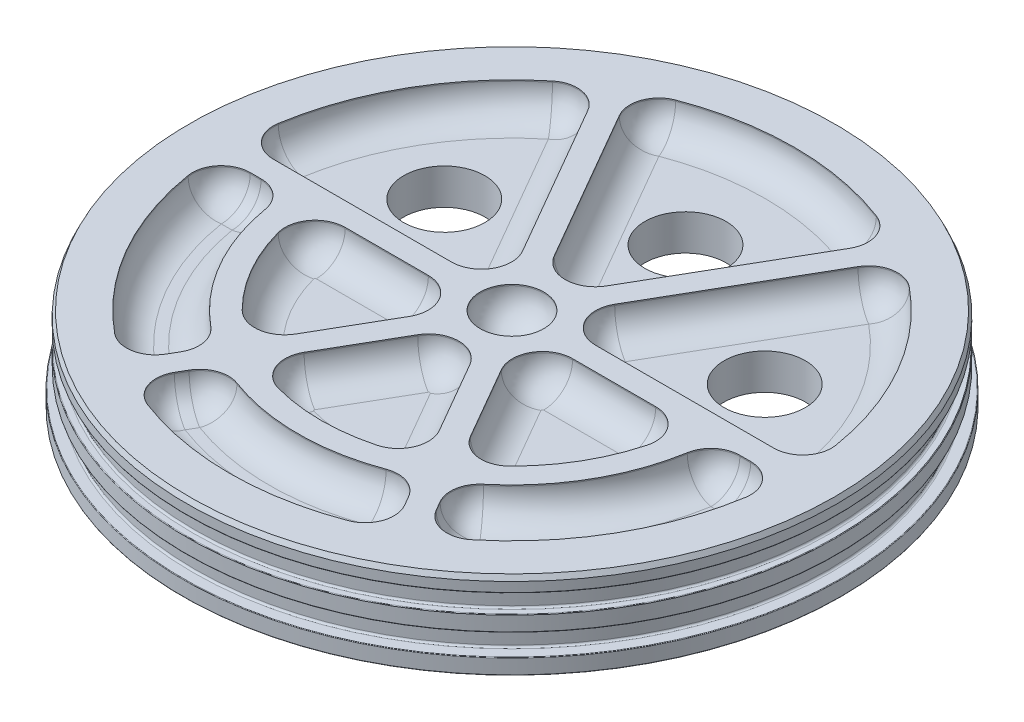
SolidWorks part; units mm, degrees
ref_plane "Front Plane" through (0, 0, 0) normal (0, 0, 1) x (1, 0, 0)
ref_plane "Top Plane" through (0, 0, 0) normal (0, 1, 0) x (1, 0, 0)
ref_plane "Right Plane" through (0, 0, 0) normal (1, 0, 0) x (0, 0, -1)
sketch "Sketch1" plane through (0, 0, 0) normal (0, 0, 1) x (1, 0, 0)
  line L0 (0, 48.1922) -> (0, -25.6743) construction
  line L1 (0, 0) -> (72.39, 0)
  line L2 (72.39, 0) -> (72.39, 3.429)
  line L3 (72.39, 3.429) -> (69.6468, 3.429)
  line L4 (69.6468, 3.429) -> (69.6468, 7.493)
  line L5 (69.6468, 7.493) -> (71.4248, 7.493)
  line L6 (71.4248, 7.493) -> (71.4248, 10.922)
  line L7 (71.4248, 10.922) -> (69.6468, 10.922)
  line L8 (62.0268, 18.288) -> (62.0268, 11.684)
  line L9 (62.0268, 11.684) -> (0, 11.684)
  line L10 (0, 11.684) -> (0, 0)
  line L11 (69.6468, 10.922) -> (69.6468, 14.986)
  line L12 (69.6468, 14.986) -> (71.4248, 14.986)
  line L13 (71.4248, 14.986) -> (71.4248, 18.288)
  line L14 (71.4248, 18.288) -> (62.0268, 18.288)
revolve "Revolve1" add sketch "Sketch1" angle 360 about L0
sketch "Sketch6" plane through (0, 0, 0) normal (0, -1, 0) x (1, 0, 0)
  circle A0 centre (0, 0) radius 66.04
  dimension "D1" = 132.08
extrude "Boss-Extrude1" add sketch "Sketch6" along normal blind 2.54
fillet "CNC ID Fillet" radius 0.4064 5 edges at (-69.6468, 7.493, 0) (-69.6468, 3.429, 0) (66.04, 0, 0) (-69.6468, 14.986, 0) (-69.6468, 10.922, 0)
fillet "CNC OD Fillet" radius 0.127 6 edges at (-71.4248, 7.493, 0) (-72.39, 3.429, 0) (-71.4248, 10.922, 0) (-71.4248, 14.986, 0) (66.04, -2.54, 0) (-72.39, 0, 0)
chamfer "CNC Chamfers" distance 0.508 angle 65 1 edges at (-71.4248, 18.288, 0)
hole_wizard "Pipe Tap Drill for 1/2 Tap - Fill Valve" positions "Sketch13" profile "Sketch14" hole size "1/2" standard "ANSI Inch"
sketch "Sketch13" plane through (0, -2.54, 0) normal (0, -1, 0) x (-1, 0, 0)
  point P4 (0, 38.1)
  dimension "D1" = 38.1
sketch "Sketch14" plane through (0, -2.54, -38.1) normal (1, 0, 0) x (0, 0, -1)
  line L0 (0, 0) -> (0, 20.828)
  line L1 (0, 20.828) -> (8.9281, 20.828)
  line L2 (8.9281, 20.828) -> (8.9281, 0)
  line L5 (8.9281, 0) -> (0, 0)
  line L11 (0, -6.35) -> (0, 107.95) construction
  dimension "Thru Hole Dia." = 17.8562
  dimension "Thru Hole Depth" = 20.828
hole_wizard "Pipe Tap Drill for 1/4 Tap - Solenoid Valve" positions "Sketch15" profile "Sketch16" hole size "1/2" standard "ANSI Inch"
sketch "Sketch15" plane through (0, -2.54, 0) normal (0, -1, 0) x (-1, 0, 0)
  line L2 (-35.1953, 20.32) -> (0, 0) construction
  line L4 (0, 0) -> (0, 38.1) construction
  point P4 (-35.1953, 20.32)
  dimension "D1" = 60
  dimension "D2" = 40.64
sketch "Sketch16" plane through (35.1953, -2.54, -20.32) normal (1, 0, 0) x (0, 0, -1)
  line L0 (0, 0) -> (0, 20.828)
  line L1 (0, 20.828) -> (8.9281, 20.828)
  line L2 (8.9281, 20.828) -> (8.9281, 0)
  line L5 (8.9281, 0) -> (0, 0)
  line L11 (0, -6.35) -> (0, 107.95) construction
  dimension "Thru Hole Dia." = 17.8562
  dimension "Thru Hole Depth" = 20.828
hole_wizard "Pipe Tap Drill for 1/2 Tap - Cryo Valve" positions "Sketch17" profile "Sketch18" hole size "1/2" standard "ANSI Inch"
sketch "Sketch17" plane through (0, -2.54, 0) normal (0, -1, 0) x (-1, 0, 0)
  line L2 (35.1953, 20.32) -> (0, 0) construction
  line L5 (0, 0) -> (0, 38.1) construction
  point P4 (35.1953, 20.32)
  dimension "D1" = 60
  dimension "D2" = 40.64
sketch "Sketch18" plane through (-35.1953, -2.54, -20.32) normal (1, 0, 0) x (0, 0, -1)
  line L0 (0, 0) -> (0, 20.828)
  line L1 (0, 20.828) -> (8.9281, 20.828)
  line L2 (8.9281, 20.828) -> (8.9281, 0)
  line L5 (8.9281, 0) -> (0, 0)
  line L11 (0, -6.35) -> (0, 107.95) construction
  dimension "Thru Hole Dia." = 17.8562
  dimension "Thru Hole Depth" = 20.828
sketch "Sketch19" plane through (0, 18.288, 0) normal (0, 1, 0) x (1, 0, 0)
  line L0 (0, 0) -> (31.0134, 53.7168) construction
  line L1 (0, 0) -> (-31.0134, 53.7168) construction
  line L2 (0, 0) -> (62.0268, 0) construction
  line L3 (0, 0) -> (0, 38.1) construction
  line L4 (0, 0) -> (31.0134, -53.7168) construction
  line L5 (0, 0) -> (-31.0134, -53.7168) construction
  line L6 (0, 0) -> (-62.0268, 0) construction
  line L7 (-5.7192, 14.986) -> (-28.8137, 54.9868)
  line L8 (-15.8379, 2.54) -> (-62.0268, 2.54)
  line L9 (-10.1186, -12.446) -> (-19.2504, -28.2626)
  line L10 (5.7192, -14.986) -> (14.851, -30.8026)
  line L11 (15.8379, -2.54) -> (34.1013, -2.54)
  line L12 (10.1186, 12.446) -> (33.2131, 52.4468)
  line L13 (-10.1186, 12.446) -> (-33.2131, 52.4468)
  line L14 (-15.8379, -2.54) -> (-34.1013, -2.54)
  line L15 (-5.7192, -14.986) -> (-14.851, -30.8026)
  line L16 (10.1186, -12.446) -> (23.1162, -34.9584)
  line L17 (15.8379, 2.54) -> (62.0268, 2.54)
  line L18 (5.7192, 14.986) -> (28.8137, 54.9868)
  line L19 (0, -2.54) -> (-62.0268, -2.54) construction
  line L20 (-2.1997, 1.27) -> (-33.2131, -52.4468) construction
  line L21 (-2.1997, -1.27) -> (28.8137, -54.9868) construction
  line L22 (2.1997, -1.27) -> (-28.8137, -54.9868) construction
  line L23 (2.1997, 1.27) -> (33.2131, -52.4468) construction
  line L24 (0, -2.54) -> (62.0268, -2.54) construction
  line L25 (0, 2.54) -> (62.0268, 2.54) construction
  line L26 (2.1997, -1.27) -> (33.2131, 52.4468) construction
  line L27 (-2.1997, 1.27) -> (28.8137, 54.9868) construction
  line L28 (2.1997, 1.27) -> (-28.8137, 54.9868) construction
  line L29 (0, 2.54) -> (-62.0268, 2.54) construction
  line L30 (-2.1997, -1.27) -> (-33.2131, 52.4468) construction
  line L31 (-46.9213, -2.54) -> (-62.0268, -2.54)
  line L32 (46.9213, -2.54) -> (62.0268, -2.54)
  line L35 (-25.6604, -39.365) -> (-33.2131, -52.4468)
  line L36 (-21.2609, -41.905) -> (-28.8137, -54.9868)
  line L37 (21.2609, -41.905) -> (28.8137, -54.9868)
  line L38 (25.6604, -39.365) -> (33.2131, -52.4468)
  circle A0 centre (0, 0) radius 6.985
  circle A2 centre (0, 0) radius 62.0268
  arc A6 (-15.8379, -2.54) -> (-10.1186, -12.446) centre (-15.8379, -9.144) cw
  arc A7 (5.7192, -14.986) -> (-5.7192, -14.986) centre (0, -18.288) ccw
  arc A8 (10.1186, -12.446) -> (15.8379, -2.54) centre (15.8379, -9.144) cw
  arc A9 (15.8379, 2.54) -> (10.1186, 12.446) centre (15.8379, 9.144) cw
  arc A10 (5.7192, 14.986) -> (-5.7192, 14.986) centre (0, 18.288) cw
  arc A11 (-15.8379, 2.54) -> (-10.1186, 12.446) centre (-15.8379, 9.144) ccw
  arc A12 (-44.3774, -2.54) -> (44.3774, -2.54) centre (0, 0) ccw construction
  arc A13 (-46.9213, -2.54) -> (-25.6604, -39.365) centre (0, 0) ccw
  arc A14 (-40.48, -10.8544) -> (-29.6402, -29.6295) centre (0, 0) ccw
  arc A15 (-41.91, 0) -> (41.91, 0) centre (0, 0) ccw construction
  arc A16 (-44.45, 0) -> (44.45, 0) centre (0, 0) ccw construction
  arc A17 (-46.99, 0) -> (46.99, 0) centre (0, 0) ccw construction
  arc A19 (-10.8398, -40.4839) -> (10.8398, -40.4839) centre (0, 0) ccw
  arc A20 (23.1162, -34.9584) -> (40.48, -10.8544) centre (0, 0) ccw
  arc A21 (-21.2609, -41.905) -> (21.2609, -41.905) centre (0, 0) ccw
  arc A22 (25.6604, -39.365) -> (46.9213, -2.54) centre (0, 0) ccw
  arc A23 (-40.48, -10.8544) -> (-34.1013, -2.54) centre (-34.1013, -9.144) cw
  arc A24 (34.1013, -2.54) -> (40.48, -10.8544) centre (34.1013, -9.144) cw
  arc A25 (14.851, -30.8026) -> (10.8398, -40.4839) centre (9.1317, -34.1046) cw
  arc A26 (-10.8398, -40.4839) -> (-14.851, -30.8026) centre (-9.1317, -34.1046) cw
  arc A27 (-29.6402, -29.6295) -> (-19.2504, -28.2626) centre (-24.9696, -24.9606) ccw
  circle A28 centre (0, 0) radius 62.0268 construction
  point P12 (0, 0)
  point P13 (0, 0)
  dimension "D1" = 30
  dimension "D5" = 6.604
  dimension "D8" = 44.45
  dimension "D9" = 6.604
  dimension "D10" = 13.97
  dimension "D2" = 6
  dimension "D3" = 2.54
  dimension "D4" = 2.54
  dimension "D6" = 2.54
  dimension "D7" = 2.54
extrude "Boss-Extrude2" add sketch "Sketch19" against normal up to next
fillet "Fillet2" radius 6.35 61 edges at (-38.9063, 11.684, -2.54) (-10.1186, 11.684, -5.842) (-17.2535, 11.684, -34.9639) (0, 11.684, -11.684) (38.9063, 11.684, -2.54) (10.1186, 11.684, -5.842) (16.6174, 11.684, 23.7022) (10.1186, 11.684, 5.842) (24.9696, 11.684, 2.54) (-10.2851, 11.684, 22.8943) (0, 11.684, 11.684) (10.2851, 11.684, 22.8943) (-24.9696, 11.684, 2.54) (-10.1186, 11.684, 5.842) (-14.6845, 11.684, 20.3543) (-21.6529, 11.684, -32.4239) (17.2535, 11.684, -34.9639) (21.6529, 11.684, -32.4239) (34.0054, 11.684, 24.4965) (0, 11.684, 41.91) (-36.2951, 11.684, 20.955) (39.341, 11.684, 5.1242) (-15.2328, 11.684, 36.6324) (15.2328, 11.684, 36.6324) (-39.341, 11.684, 5.1242) (-24.1082, 11.684, 31.5082) (29.4237, 11.684, 45.8834) (40.6945, 11.684, 23.495) (54.448, 11.684, 2.54) (-25.0243, 11.684, 48.4234) (0, 11.684, 46.99) (25.0243, 11.684, 48.4234) (-54.448, 11.684, 2.54) (-40.6945, 11.684, 23.495) (-29.4237, 11.684, 45.8834) (46.9213, 14.986, 2.54) (25.6604, 14.986, 39.365) (21.2609, 14.986, 41.905) (-21.2609, 14.986, 41.905) (-25.6604, 14.986, 39.365) (-46.9213, 14.986, 2.54) (33.1871, 14.986, 52.4017) (61.9748, 14.986, 2.54) (-28.7877, 14.986, 54.9417) (28.7877, 14.986, 54.9417) (-61.9748, 14.986, 2.54) (-33.1871, 14.986, 52.4017) (-61.9748, 14.986, -2.54) (-33.1871, 14.986, -52.4017) (-28.7877, 14.986, -54.9417) (28.7877, 14.986, -54.9417) (61.9748, 14.986, -2.54) (33.1871, 14.986, -52.4017) (53.7168, 11.684, 31.0134) (0, 11.684, 62.0268) (-53.7168, 11.684, 31.0134) (-53.7168, 11.684, -31.0134) (53.7168, 11.684, -31.0134) (0, 11.684, -62.0268) (6.985, 11.684, 0) (23.1162, 14.986, 34.9584)
sketch "Sketch21" plane through (0, 18.288, 0) normal (0, 1, 0) x (1, 0, 0)
  circle A0 centre (0, 0) radius 66.3169 construction
  text T0 "                                                                                                                                                           RELEVANT EXPERIENCE"
sketch "Sketch22" plane through (0, -2.54, 0) normal (0, -1, 0) x (1, 0, 0)
  line L39 (-29.6809, -46.3289) -> (-10.1186, -12.446)
  line L59 (-15.8379, -2.54) -> (-54.9625, -2.54)
  line L74 (-29.6809, -46.3289) -> (-10.1186, -12.446)
  line L78 (-15.8379, -2.54) -> (-54.9625, -2.54)
  line L82 (-34.1013, 2.54) -> (-15.8379, 2.54)
  line L86 (-10.1186, 12.446) -> (-19.2504, 28.2626)
  line L90 (-34.1013, 2.54) -> (-15.8379, 2.54)
  line L94 (-10.1186, 12.446) -> (-19.2504, 28.2626)
  line L98 (15.8379, 2.54) -> (34.1013, 2.54)
  line L101 (19.4151, 28.548) -> (10.1186, 12.446)
  line L102 (15.8379, 2.54) -> (34.1013, 2.54)
  line L103 (19.4151, 28.548) -> (10.1186, 12.446)
  line L104 (-14.851, 30.8026) -> (-5.7192, 14.986)
  line L105 (5.7192, 14.986) -> (14.851, 30.8026)
  line L106 (-14.851, 30.8026) -> (-5.7192, 14.986)
  line L107 (5.7192, 14.986) -> (14.851, 30.8026)
  line L108 (-28.4967, 44.2777) -> (-29.6809, 46.3289)
  line L109 (-54.9625, 2.54) -> (-52.5939, 2.54)
  line L110 (-28.4967, 44.2777) -> (-29.6809, 46.3289)
  line L111 (-54.9625, 2.54) -> (-52.5939, 2.54)
  line L112 (24.0973, 46.8177) -> (25.2815, 48.8689)
  line L113 (-25.2815, 48.8689) -> (-24.0973, 46.8177)
  line L114 (24.0973, 46.8177) -> (25.2815, 48.8689)
  line L115 (-25.2815, 48.8689) -> (-24.0973, 46.8177)
  line L116 (52.5939, 2.54) -> (54.9625, 2.54)
  line L117 (29.6809, 46.3289) -> (28.4967, 44.2777)
  line L118 (52.5939, 2.54) -> (54.9625, 2.54)
  line L119 (29.6809, 46.3289) -> (28.4967, 44.2777)
  line L120 (10.1186, -12.446) -> (29.6809, -46.3289)
  line L121 (54.9625, -2.54) -> (15.8379, -2.54)
  line L122 (10.1186, -12.446) -> (29.6809, -46.3289)
  line L123 (54.9625, -2.54) -> (15.8379, -2.54)
  line L124 (-5.7192, -14.986) -> (-25.2815, -48.8689)
  line L125 (25.2815, -48.8689) -> (5.7192, -14.986)
  line L126 (-5.7192, -14.986) -> (-25.2815, -48.8689)
  line L127 (25.2815, -48.8689) -> (5.7192, -14.986)
  circle A3 centre (0, 0) radius 6.985
  circle A93 centre (0, 0) radius 6.985
  arc A205 (-61.231, -9.9039) -> (-39.1925, -48.0757) centre (0, 0) ccw
  arc A214 (-39.1925, -48.0757) -> (-29.6809, -46.3289) centre (-35.1802, -43.1539) ccw
  arc A217 (-10.1186, -12.446) -> (-15.8379, -2.54) centre (-15.8379, -9.144) ccw
  arc A229 (-54.9625, -2.54) -> (-61.231, -9.9039) centre (-54.9625, -8.89) ccw
  arc A241 (-61.231, -9.9039) -> (-39.1925, -48.0757) centre (0, 0) ccw
  arc A267 (-39.1925, -48.0757) -> (-29.6809, -46.3289) centre (-35.1802, -43.1539) ccw
  arc A268 (-10.1186, -12.446) -> (-15.8379, -2.54) centre (-15.8379, -9.144) ccw
  arc A269 (-54.9625, -2.54) -> (-61.231, -9.9039) centre (-54.9625, -8.89) ccw
  arc A270 (-19.2504, 28.2626) -> (-29.6402, 29.6295) centre (-24.9696, 24.9606) ccw
  arc A271 (-29.6402, 29.6295) -> (-40.48, 10.8544) centre (0, 0) ccw
  arc A272 (-40.48, 10.8544) -> (-34.1013, 2.54) centre (-34.1013, 9.144) ccw
  arc A273 (-15.8379, 2.54) -> (-10.1186, 12.446) centre (-15.8379, 9.144) ccw
  arc A274 (-19.2504, 28.2626) -> (-29.6402, 29.6295) centre (-24.9696, 24.9606) ccw
  arc A275 (-29.6402, 29.6295) -> (-40.48, 10.8544) centre (0, 0) ccw
  arc A276 (-40.48, 10.8544) -> (-34.1013, 2.54) centre (-34.1013, 9.144) ccw
  arc A277 (-15.8379, 2.54) -> (-10.1186, 12.446) centre (-15.8379, 9.144) ccw
  arc A278 (34.1013, 2.54) -> (40.48, 10.8544) centre (34.1013, 9.144) ccw
  arc A279 (40.48, 10.8544) -> (29.3634, 29.9039) centre (0, 0) ccw
  arc A280 (29.3634, 29.9039) -> (19.4151, 28.548) centre (24.9144, 25.373) ccw
  arc A281 (10.1186, 12.446) -> (15.8379, 2.54) centre (15.8379, 9.144) ccw
  arc A282 (34.1013, 2.54) -> (40.48, 10.8544) centre (34.1013, 9.144) ccw
  arc A283 (40.48, 10.8544) -> (29.3634, 29.9039) centre (0, 0) ccw
  arc A284 (29.3634, 29.9039) -> (19.4151, 28.548) centre (24.9144, 25.373) ccw
  arc A285 (10.1186, 12.446) -> (15.8379, 2.54) centre (15.8379, 9.144) ccw
  arc A286 (10.8398, 40.4839) -> (-10.8398, 40.4839) centre (0, 0) ccw
  arc A287 (-10.8398, 40.4839) -> (-14.851, 30.8026) centre (-9.1317, 34.1046) ccw
  arc A288 (-5.7192, 14.986) -> (5.7192, 14.986) centre (0, 18.288) ccw
  arc A289 (14.851, 30.8026) -> (10.8398, 40.4839) centre (9.1317, 34.1046) ccw
  arc A290 (10.8398, 40.4839) -> (-10.8398, 40.4839) centre (0, 0) ccw
  arc A291 (-10.8398, 40.4839) -> (-14.851, 30.8026) centre (-9.1317, 34.1046) ccw
  arc A292 (-5.7192, 14.986) -> (5.7192, 14.986) centre (0, 18.288) ccw
  arc A293 (14.851, 30.8026) -> (10.8398, 40.4839) centre (9.1317, 34.1046) ccw
  arc A296 (29.6809, -46.3289) -> (39.1925, -48.0757) centre (35.1802, -43.1539) ccw
  arc A297 (39.1925, -48.0757) -> (61.231, -9.9039) centre (0, 0) ccw
  arc A298 (-29.9488, 36.2095) -> (-46.3328, 7.8317) centre (0, 0) ccw
  arc A299 (-29.9488, 36.2095) -> (-28.4967, 44.2777) centre (-33.9959, 41.1027) ccw
  arc A300 (-29.6809, 46.3289) -> (-39.1925, 48.0757) centre (-35.1802, 43.1539) ccw
  arc A301 (-39.1925, 48.0757) -> (-61.231, 9.9039) centre (0, 0) ccw
  arc A302 (-61.231, 9.9039) -> (-54.9625, 2.54) centre (-54.9625, 8.89) ccw
  arc A303 (-52.5939, 2.54) -> (-46.3328, 7.8317) centre (-52.5939, 8.89) ccw
  arc A304 (-29.9488, 36.2095) -> (-46.3328, 7.8317) centre (0, 0) ccw
  arc A305 (-29.9488, 36.2095) -> (-28.4967, 44.2777) centre (-33.9959, 41.1027) ccw
  arc A306 (-29.6809, 46.3289) -> (-39.1925, 48.0757) centre (-35.1802, 43.1539) ccw
  arc A307 (-39.1925, 48.0757) -> (-61.231, 9.9039) centre (0, 0) ccw
  arc A308 (-61.231, 9.9039) -> (-54.9625, 2.54) centre (-54.9625, 8.89) ccw
  arc A309 (-52.5939, 2.54) -> (-46.3328, 7.8317) centre (-52.5939, 8.89) ccw
  arc A310 (16.384, 44.0412) -> (-16.384, 44.0412) centre (0, 0) ccw
  arc A311 (16.384, 44.0412) -> (24.0973, 46.8177) centre (18.598, 49.9927) ccw
  arc A312 (25.2815, 48.8689) -> (22.0385, 57.9796) centre (19.7823, 52.0439) ccw
  arc A313 (22.0385, 57.9796) -> (-22.0385, 57.9796) centre (0, 0) ccw
  arc A314 (-22.0385, 57.9796) -> (-25.2815, 48.8689) centre (-19.7823, 52.0439) ccw
  arc A315 (-24.0973, 46.8177) -> (-16.384, 44.0412) centre (-18.598, 49.9927) ccw
  arc A316 (16.384, 44.0412) -> (-16.384, 44.0412) centre (0, 0) ccw
  arc A317 (16.384, 44.0412) -> (24.0973, 46.8177) centre (18.598, 49.9927) ccw
  arc A318 (25.2815, 48.8689) -> (22.0385, 57.9796) centre (19.7823, 52.0439) ccw
  arc A319 (22.0385, 57.9796) -> (-22.0385, 57.9796) centre (0, 0) ccw
  arc A320 (-22.0385, 57.9796) -> (-25.2815, 48.8689) centre (-19.7823, 52.0439) ccw
  arc A321 (-24.0973, 46.8177) -> (-16.384, 44.0412) centre (-18.598, 49.9927) ccw
  arc A322 (46.3328, 7.8317) -> (29.9488, 36.2095) centre (0, 0) ccw
  arc A323 (46.3328, 7.8317) -> (52.5939, 2.54) centre (52.5939, 8.89) ccw
  arc A324 (54.9625, 2.54) -> (61.231, 9.9039) centre (54.9625, 8.89) ccw
  arc A325 (61.231, 9.9039) -> (39.1925, 48.0757) centre (0, 0) ccw
  arc A326 (39.1925, 48.0757) -> (29.6809, 46.3289) centre (35.1802, 43.1539) ccw
  arc A327 (28.4967, 44.2777) -> (29.9488, 36.2095) centre (33.9959, 41.1027) ccw
  arc A328 (46.3328, 7.8317) -> (29.9488, 36.2095) centre (0, 0) ccw
  arc A329 (46.3328, 7.8317) -> (52.5939, 2.54) centre (52.5939, 8.89) ccw
  arc A330 (54.9625, 2.54) -> (61.231, 9.9039) centre (54.9625, 8.89) ccw
  arc A331 (61.231, 9.9039) -> (39.1925, 48.0757) centre (0, 0) ccw
  arc A332 (39.1925, 48.0757) -> (29.6809, 46.3289) centre (35.1802, 43.1539) ccw
  arc A333 (28.4967, 44.2777) -> (29.9488, 36.2095) centre (33.9959, 41.1027) ccw
  arc A334 (61.231, -9.9039) -> (54.9625, -2.54) centre (54.9625, -8.89) ccw
  arc A335 (15.8379, -2.54) -> (10.1186, -12.446) centre (15.8379, -9.144) ccw
  arc A336 (29.6809, -46.3289) -> (39.1925, -48.0757) centre (35.1802, -43.1539) ccw
  arc A337 (39.1925, -48.0757) -> (61.231, -9.9039) centre (0, 0) ccw
  arc A338 (61.231, -9.9039) -> (54.9625, -2.54) centre (54.9625, -8.89) ccw
  arc A339 (15.8379, -2.54) -> (10.1186, -12.446) centre (15.8379, -9.144) ccw
  arc A340 (-25.2815, -48.8689) -> (-22.0385, -57.9796) centre (-19.7823, -52.0439) ccw
  arc A341 (-22.0385, -57.9796) -> (22.0385, -57.9796) centre (0, 0) ccw
  arc A342 (22.0385, -57.9796) -> (25.2815, -48.8689) centre (19.7823, -52.0439) ccw
  arc A343 (5.7192, -14.986) -> (-5.7192, -14.986) centre (0, -18.288) ccw
  arc A344 (-25.2815, -48.8689) -> (-22.0385, -57.9796) centre (-19.7823, -52.0439) ccw
  arc A345 (-22.0385, -57.9796) -> (22.0385, -57.9796) centre (0, 0) ccw
  arc A346 (22.0385, -57.9796) -> (25.2815, -48.8689) centre (19.7823, -52.0439) ccw
  arc A347 (5.7192, -14.986) -> (-5.7192, -14.986) centre (0, -18.288) ccw
  dimension "D1" = 0
  dimension "D2" = 0
  dimension "D3" = 0
  dimension "D4" = 0
  dimension "D5" = 0
  dimension "D6" = 0
  dimension "D7" = 0
  dimension "D8" = 0
  dimension "D9" = 0
  dimension "D10" = 0
extrude "Cut-Extrude1" cut sketch "Sketch22" against normal blind 6.35
fillet "Fillet3" radius 6.35 61 edges at (59.7978, 3.81, -4.7739) (53.7168, 3.81, -31.0134) (34.0332, 3.81, -49.3995) (19.8998, 3.81, -29.3875) (10.1186, 3.81, -5.842) (-10.1186, 3.81, -5.842) (-19.8998, 3.81, -29.3875) (-34.0332, 3.81, -49.3995) (-53.7168, 3.81, -31.0134) (-59.7978, 3.81, -4.7739) (0, 3.81, -11.684) (15.5004, 3.81, -31.9275) (25.7646, 3.81, -54.1734) (0, 3.81, -62.0268) (-25.7646, 3.81, -54.1734) (-40.6945, 3.81, 23.495) (-48.495, 3.81, 4.0401) (-53.7782, 3.81, 2.54) (-59.7978, 3.81, 4.7739) (-53.7168, 3.81, 31.0134) (-34.0332, 3.81, 49.3995) (-29.0888, 3.81, 45.3033) (-27.7464, 3.81, 39.9779) (0, 3.81, 46.99) (-20.7487, 3.81, 44.018) (-24.6894, 3.81, 47.8433) (-25.7646, 3.81, 54.1734) (0, 3.81, 62.0268) (25.7646, 3.81, 54.1734) (24.6894, 3.81, 47.8433) (20.7487, 3.81, 44.018) (40.6945, 3.81, 23.495) (27.7464, 3.81, 39.9779) (29.0888, 3.81, 45.3033) (34.0332, 3.81, 49.3995) (53.7168, 3.81, 31.0134) (59.7978, 3.81, 4.7739) (53.7782, 3.81, 2.54) (48.495, 3.81, 4.0401) (14.7669, 3.81, 20.497) (24.0568, 3.81, 31.6648) (36.1973, 3.81, 21.1235) (39.341, 3.81, 5.1242) (24.9696, 3.81, 2.54) (10.1186, 3.81, 5.842) (10.2851, 3.81, 22.8943) (0, 3.81, 11.684) (-10.2851, 3.81, 22.8943) (-15.2328, 3.81, 36.6324) (0, 3.81, 41.91) (15.2328, 3.81, 36.6324) (-10.1186, 3.81, 5.842) (-24.9696, 3.81, 2.54) (-39.341, 3.81, 5.1242) (-36.2951, 3.81, 20.955) (-24.1082, 3.81, 31.5082) (-14.6845, 3.81, 20.3543) (6.985, 3.81, 0) (35.4002, 3.81, -2.54) (-35.4002, 3.81, -2.54) (-15.5004, 3.81, -31.9275)
sketch "Sketch20" plane through (0, 3.81, 0) normal (0, -1, 0) x (-1, 0, 0)
  line L0 (0, 0) -> (-35.1953, 20.32) construction
  line L1 (-40.2753, 11.5212) -> (-30.1153, 29.1188) construction
  line L2 (-11.43, 38.1) -> (11.43, 38.1) construction
  line L3 (0, 0) -> (0, 38.1) construction
  line L4 (40.2753, 11.5212) -> (30.1153, 29.1188) construction
  line L5 (0, 0) -> (35.1953, 20.32) construction
  arc A1 (11.43, 38.1) -> (-11.43, 38.1) centre (0, 38.1) ccw construction
  arc A2 (11.43, 38.1) -> (-11.43, 38.1) centre (0, 38.1) cw construction
  arc A3 (-40.2753, 11.5212) -> (-30.1153, 29.1188) centre (-35.1953, 20.32) ccw construction
  arc A4 (-40.2753, 11.5212) -> (-30.1153, 29.1188) centre (-35.1953, 20.32) cw construction
  arc A5 (40.2753, 11.5212) -> (30.1153, 29.1188) centre (35.1953, 20.32) ccw construction
  arc A6 (40.2753, 11.5212) -> (30.1153, 29.1188) centre (35.1953, 20.32) cw construction
  text T1 "FILL" font "Century Gothic" height in points 20
  text T3 "INJECTOR" font "Century Gothic" height in points 12
  text T4 "DUMP" font "Century Gothic" height in points 14
  point P14 (-35.1953, 20.32)
  dimension "D1" = 11.43
  dimension "D2" = 10.16
sketch "Sketch24" plane through (0, -2.54, 0) normal (0, -1, 0) x (1, 0, 0)
  arc A0 (-42.672, 0) -> (42.672, 0) centre (0, 0) cw construction
  text T0 "THIS SIDE OUT" font "Century Gothic" height in points 12
  dimension "D1" = 42.672
equation "\"D6@Sketch1\"=5.484/2"
equation "\"D1@Sketch1\"=5.7/2"
